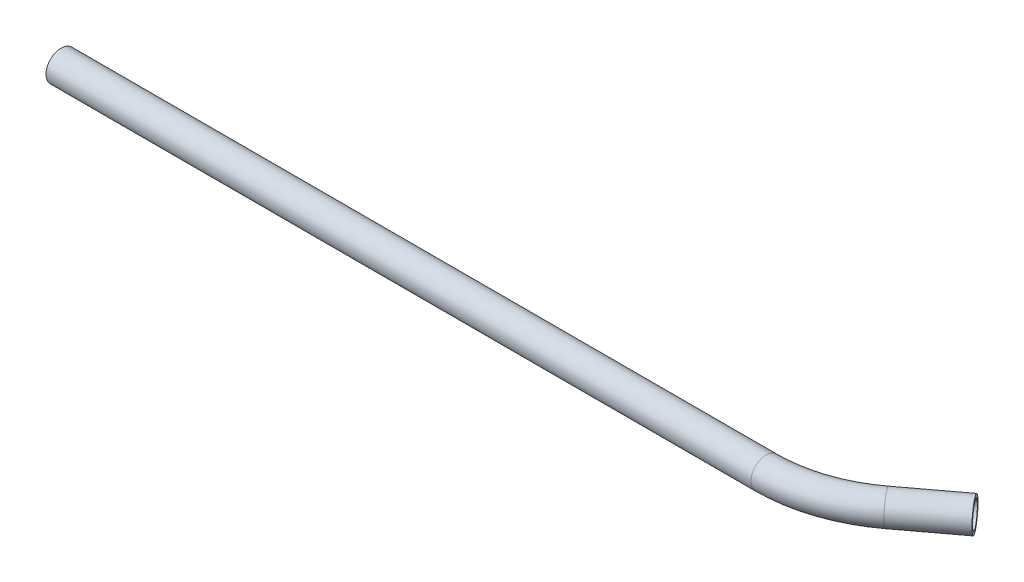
SolidWorks part; units mm, degrees
ref_plane "Face" through (0, 0, 0) normal (0, 0, 1) x (1, 0, 0)
ref_plane "Dessus" through (0, 0, 0) normal (0, 1, 0) x (1, 0, 0)
ref_plane "Droite" through (0, 0, 0) normal (1, 0, 0) x (0, 0, -1)
sketch "Esquisse2" plane through (0, 0, 0) normal (0, 1, 0) x (1, 0, 0)
  line L0 (0, 0) -> (46.6667, 0)
  line L1 (52.6667, 2) -> (56, 4.5)
  arc A0 (52.6667, 2) -> (46.6667, 0) centre (46.6667, 10) cw
  point P6 (50, 0)
  dimension "D4" = 10
  dimension "D1" = 50
  dimension "D2" = 6
  dimension "D3" = 4.5
sketch "Esquisse3" plane through (0, 0, 0) normal (1, 0, 0) x (0, 0, -1)
  circle A0 centre (0, 0) radius 1
  circle A1 centre (0, 0) radius 0.8
  dimension "D1" = 2
  dimension "D2" = 1.6
sweep "Balayage1" add profiles "Esquisse3" path "Esquisse2"
